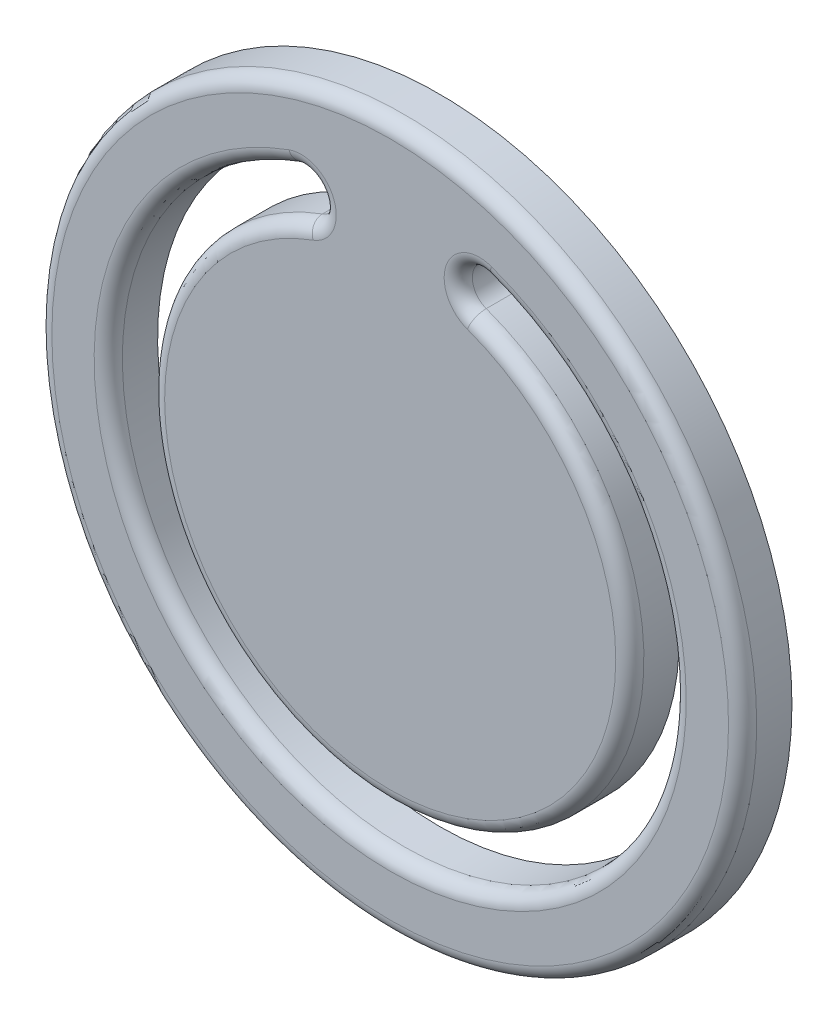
SolidWorks part; units mm, degrees
ref_plane "Vorne" through (0, 0, 0) normal (0, 0, 1) x (1, 0, 0)
ref_plane "Oben" through (0, 0, 0) normal (0, 1, 0) x (1, 0, 0)
ref_plane "Rechts" through (0, 0, 0) normal (1, 0, 0) x (0, 0, -1)
sketch "Skizze1" plane through (0, 0, 0) normal (0, 0, 1) x (1, 0, 0)
  line L0 (0, 4.2618) -> (0, -20.7382) construction
  circle A0 centre (0, 0) radius 25
  arc A1 (-6.8404, 18.7939) -> (6.8404, 18.7939) centre (0, 0) ccw
  arc A2 (-5.8143, 15.9748) -> (5.8143, 15.9748) centre (0, 0) ccw
  arc A3 (5.8143, 15.9748) -> (6.8404, 18.7939) centre (6.3274, 17.3843) cw
  arc A4 (-5.8143, 15.9748) -> (-6.8404, 18.7939) centre (-6.3274, 17.3843) ccw
extrude "Basis-Linear austragen" add sketch "Skizze1" along normal blind 3.5
fillet "Verrundung1" radius 1 1 edges at (25, 0, 3.5)
fillet "Verrundung3" radius 1 4 edges at (0, -20, 3.5) (4.9178, 17.8973, 3.5) (0, -17, 3.5) (-4.9178, 17.8973, 3.5)
shell "Wandung1" [suppressed] thickness 1.5
fillet "Verrundung4" [suppressed] radius 0.5
